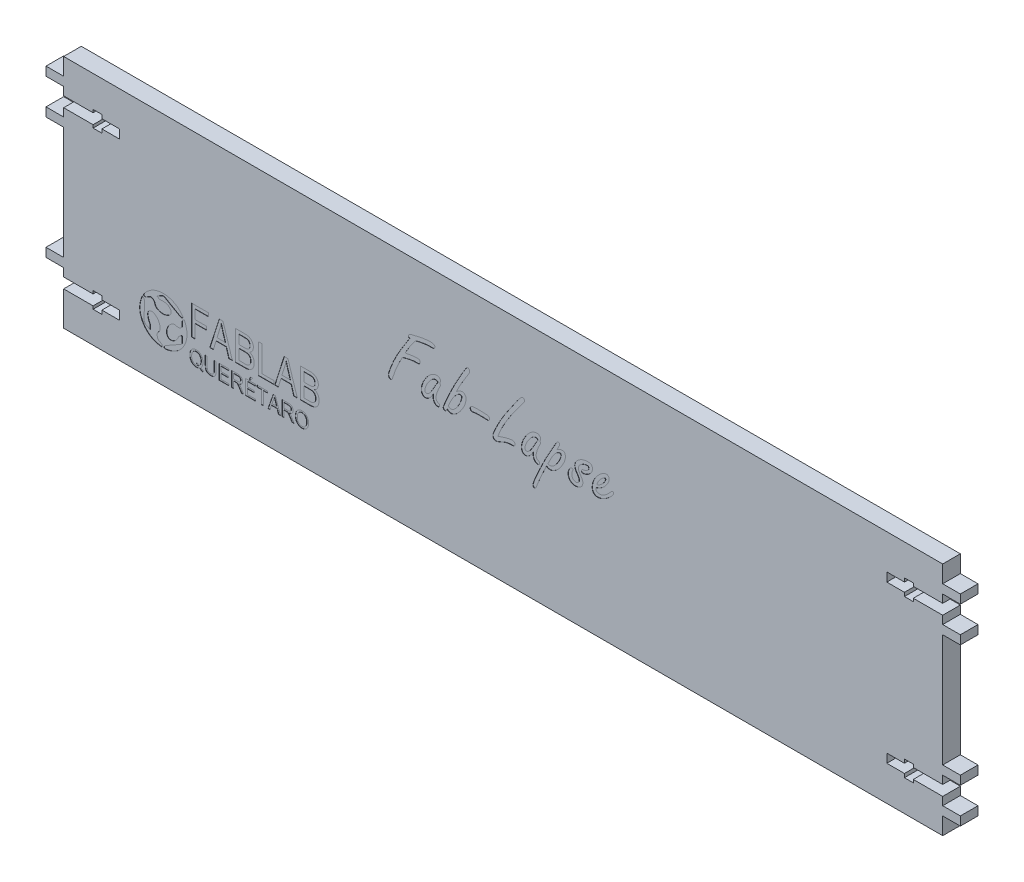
SolidWorks part; units mm, degrees
ref_plane "Front Plane" through (0, 0, 0) normal (0, 0, 1) x (1, 0, 0)
ref_plane "Top Plane" through (0, 0, 0) normal (0, 1, 0) x (1, 0, 0)
ref_plane "Right Plane" through (0, 0, 0) normal (1, 0, 0) x (0, 0, -1)
sketch "Sketch1" plane through (0, 0, 0) normal (0, 0, 1) x (1, 0, 0)
  line L1 (149.4, -40) -> (-149.4, -40)
  line L2 (149.4, -40) -> (149.4, 40)
  line L3 (149.4, 40) -> (-149.4, 40)
  line L4 (-149.4, -40) -> (-149.4, 40)
  line L5 (149.4, -40) -> (-149.4, 40) construction
  line L6 (149.4, 40) -> (-149.4, -40) construction
  point P0 (0, 0)
  dimension "D1" = 298.8
  dimension "D2" = 80
extrude "Boss-Extrude1" add sketch "Sketch1" along normal mid plane 6
sketch "Sketch2" plane through (0, 0, 3) normal (0, 0, 1) x (1, 0, 0)
  line L0 (0, 0) -> (0, 40)
  line L1 (149.4, 40) -> (-149.4, 40) construction
  line L2 (-149.4, 0) -> (0, 0) construction
  line L3 (-149.4, 40) -> (-149.4, -40) construction
  line L4 (149.4, 40) -> (155.4, 40) construction
  line L5 (155.4, 40) -> (155.4, -40) construction
  line L6 (155.4, -40) -> (149.4, -40) construction
  line L7 (155.4, 26.6667) -> (149.4, 26.6667) construction
  line L8 (149.4, -40) -> (149.4, 40) construction
  line L9 (149.4, 22.1667) -> (155.4, 22.1667)
  line L10 (149.4, 34.1667) -> (155.4, 34.1667)
  line L11 (149.4, 34.1667) -> (149.4, 31.1667)
  line L12 (149.4, 31.1667) -> (155.4, 31.1667)
  line L13 (155.4, 34.1667) -> (155.4, 31.1667)
  line L14 (155.4, 19.1667) -> (155.4, 22.1667)
  line L15 (149.4, 19.1667) -> (155.4, 19.1667)
  line L16 (149.4, 19.1667) -> (149.4, 22.1667)
  line L17 (149.4, -19.1667) -> (149.4, -22.1667)
  line L18 (149.4, -19.1667) -> (155.4, -19.1667)
  line L19 (155.4, -19.1667) -> (155.4, -22.1667)
  line L20 (149.4, -22.1667) -> (155.4, -22.1667)
  line L21 (149.4, -31.1667) -> (155.4, -31.1667)
  line L22 (155.4, -34.1667) -> (155.4, -31.1667)
  line L23 (149.4, -34.1667) -> (155.4, -34.1667)
  line L24 (149.4, -34.1667) -> (149.4, -31.1667)
  line L25 (-149.4, 19.1667) -> (-149.4, 22.1667)
  line L26 (-149.4, 19.1667) -> (-155.4, 19.1667)
  line L27 (-155.4, 19.1667) -> (-155.4, 22.1667)
  line L28 (-149.4, 22.1667) -> (-155.4, 22.1667)
  line L29 (-149.4, 31.1667) -> (-155.4, 31.1667)
  line L30 (-155.4, 34.1667) -> (-155.4, 31.1667)
  line L31 (-149.4, 34.1667) -> (-155.4, 34.1667)
  line L32 (-149.4, 34.1667) -> (-149.4, 31.1667)
  line L33 (-149.4, -34.1667) -> (-149.4, -31.1667)
  line L34 (-149.4, -34.1667) -> (-155.4, -34.1667)
  line L35 (-155.4, -34.1667) -> (-155.4, -31.1667)
  line L36 (-149.4, -31.1667) -> (-155.4, -31.1667)
  line L37 (-149.4, -19.1667) -> (-155.4, -19.1667)
  line L38 (-155.4, -19.1667) -> (-155.4, -22.1667)
  line L39 (-149.4, -22.1667) -> (-155.4, -22.1667)
  line L40 (-149.4, -19.1667) -> (-149.4, -22.1667)
  point P22 (155.4, 32.6667)
extrude "Boss-Extrude3" add sketch "Sketch2" against normal up to surface (6 mm away) contours L31 L30 L29 M22 | L28 L27 L26 M22 | L39 L37 L38 M22 | L13 L10 L12 M24 | L15 L14 L9 M24 | L20 L19 L18 M24 | L23 L22 L21 M24
sketch "Sketch4" plane through (0, 0, 3) normal (0, 0, 1) x (1, 0, 0)
  line L0 (0, 40) -> (0, 0) construction
  line L1 (149.4, 40) -> (-149.4, 40) construction
  line L2 (0, 0) -> (149.4, 0) construction
  line L3 (149.4, -19.1667) -> (149.4, 19.1667) construction
  line L4 (149.4, 31.1667) -> (149.4, 22.1667) construction
  line L5 (149.4, 22.1667) -> (149.4, -22.1667) construction
  line L6 (149.4, -22.1667) -> (149.4, -31.1667) construction
  line L7 (139.4, 24.9167) -> (139.4, 23.9108)
  line L8 (139.4, 28.4167) -> (149.4, 28.4167)
  line L10 (139.4, 24.9167) -> (149.4, 24.9167)
  line L11 (149.4, 28.4167) -> (149.4, 24.9167)
  line L12 (136.4, 29.4226) -> (139.4, 29.4226)
  line L13 (136.4, 29.4226) -> (136.4, 28.1667)
  line L14 (136.4, 23.9108) -> (139.4, 23.9108)
  line L15 (139.4, 29.4226) -> (139.4, 28.4167)
  line L16 (130.4, 28.1667) -> (136.4, 28.1667)
  line L17 (130.4, 28.1667) -> (130.4, 25.1667)
  line L18 (130.4, 25.1667) -> (136.4, 25.1667)
  line L20 (136.4, 25.1667) -> (136.4, 23.9108)
  line L21 (130.4, 26.6667) -> (149.4, 26.6667) construction
  line L22 (136.4, -29.4226) -> (136.4, -28.1667)
  line L23 (130.4, -28.1667) -> (136.4, -28.1667)
  line L24 (130.4, -28.1667) -> (130.4, -25.1667)
  line L25 (130.4, -25.1667) -> (136.4, -25.1667)
  line L26 (136.4, -25.1667) -> (136.4, -23.9108)
  line L27 (136.4, -23.9108) -> (139.4, -23.9108)
  line L28 (139.4, -24.9167) -> (139.4, -23.9108)
  line L29 (139.4, -24.9167) -> (149.4, -24.9167)
  line L30 (149.4, -28.4167) -> (149.4, -24.9167)
  line L31 (139.4, -28.4167) -> (149.4, -28.4167)
  line L32 (139.4, -29.4226) -> (139.4, -28.4167)
  line L33 (136.4, -29.4226) -> (139.4, -29.4226)
  line L34 (-136.4, -29.4226) -> (-139.4, -29.4226)
  line L35 (-139.4, -29.4226) -> (-139.4, -28.4167)
  line L36 (-139.4, -28.4167) -> (-149.4, -28.4167)
  line L37 (-149.4, -28.4167) -> (-149.4, -24.9167)
  line L38 (-139.4, -24.9167) -> (-149.4, -24.9167)
  line L39 (-139.4, -24.9167) -> (-139.4, -23.9108)
  line L40 (-136.4, -23.9108) -> (-139.4, -23.9108)
  line L41 (-136.4, -25.1667) -> (-136.4, -23.9108)
  line L42 (-130.4, -25.1667) -> (-136.4, -25.1667)
  line L43 (-130.4, -28.1667) -> (-130.4, -25.1667)
  line L44 (-130.4, -28.1667) -> (-136.4, -28.1667)
  line L45 (-136.4, -29.4226) -> (-136.4, -28.1667)
  line L46 (-136.4, 29.4226) -> (-136.4, 28.1667)
  line L47 (-130.4, 28.1667) -> (-136.4, 28.1667)
  line L48 (-130.4, 28.1667) -> (-130.4, 25.1667)
  line L49 (-130.4, 25.1667) -> (-136.4, 25.1667)
  line L50 (-136.4, 25.1667) -> (-136.4, 23.9108)
  line L51 (-136.4, 23.9108) -> (-139.4, 23.9108)
  line L52 (-139.4, 24.9167) -> (-139.4, 23.9108)
  line L53 (-139.4, 24.9167) -> (-149.4, 24.9167)
  line L54 (-149.4, 28.4167) -> (-149.4, 24.9167)
  line L55 (-139.4, 28.4167) -> (-149.4, 28.4167)
  line L56 (-139.4, 29.4226) -> (-139.4, 28.4167)
  line L57 (-136.4, 29.4226) -> (-139.4, 29.4226)
  line L58 (155.4, 31.1667) -> (155.4, 34.1667) construction
  point P30 (149.4, 26.6667)
  dimension "D1" = 3
  dimension "D2" = 25
  dimension "D3" = 3
  dimension "D4" = 5.5118
  dimension "D5" = 3.5
  dimension "D6" = 10
extrude "Cut-Extrude1" cut sketch "Sketch4" against normal through all
sketch "Sketch5" plane through (0, 0, 3) normal (0, 0, 1) x (1, 0, 0)
  line L0 (103.4598, 0) -> (-103.4598, 0) construction
  line L1 (-103.4598, 0) -> (-103.4598, -25.4098) construction
  line L2 (-103.4598, -25.4098) -> (-53.2233, -25.4098) construction
  line L3 (103.4598, 0) -> (103.4598, 21.5012) construction
  line L4 (103.4598, 21.5012) -> (65.08, 21.5012) construction
  line L5 (-106.8599, -20.8535) -> (-6.8599, -20.8535) construction
  line L6 (-106.8599, -12.832) -> (-106.8599, -28.8751) construction
  line L7 (-106.8599, -28.8751) -> (-6.8599, -28.8751) construction
  spline S41 degree 3 poles (-110.4424, -23.253) (-110.8115, -24.1562) (-111.4476, -24.8662) (-112.4127, -25.189) knots 7 7 7 7 8 8 8 8
  spline S42 degree 3 poles (-109.9657, -16.6792) (-111.6642, -15.6576) (-113.3896, -14.6793) (-115.1231, -13.7177) knots 2 2 2 2 3 3 3 3
  spline S43 degree 3 poles (-112.4127, -25.189) (-113.4, -25.519) (-114.188, -25.0436) (-114.3863, -24.0234) knots 8 8 8 8 9 9 9 9
  spline S44 degree 3 poles (-109.095, -23.8658) (-109.1369, -23.3168) (-109.1046, -22.7618) (-109.1046, -22.1295) knots 5 5 5 5 6 6 6 6
  spline S45 degree 3 poles (-115.1439, -28.8751) (-115.3462, -28.3496) (-115.2144, -28.037) (-114.7246, -27.7655) knots 2 2 2 2 3 3 3 3
  spline S46 degree 3 poles (-117.6442, -14.6795) (-117.1502, -15.0664) (-116.7191, -15.2634) (-116.1289, -15.1792) knots 5 5 5 5 6 6 6 6
  spline S47 degree 3 poles (-116.6979, -24.255) (-116.7618, -24.4751) (-116.8679, -24.7463) (-117.042, -24.8602) knots 10 10 10 10 11 11 11 11
  spline S48 degree 3 poles (-118.5425, -16.9452) (-118.6749, -16.4107) (-119.5806, -15.8104) (-120.0708, -16.073) knots 10 10 10 10 11 11 11 11
  spline S49 degree 3 poles (-109.1074, -19.3488) (-109.0921, -18.9392) (-109.071, -18.5252) (-109.1129, -18.1195) knots 12 12 12 12 13 13 13 13
  spline S50 degree 3 poles (-109.6631, -24.8854) (-109.2152, -24.6385) (-109.0576, -24.3573) (-109.095, -23.8658) knots 4 4 4 4 5 5 5 5
  spline S51 degree 3 poles (-122.3832, -24.9877) (-123.9049, -22.4692) (-123.8961, -19.8451) (-122.6854, -17.1803) knots 1 1 1 1 2 2 2 2
  spline S52 degree 3 poles (-108.7616, -16.5421) (-109.1199, -16.9739) (-109.4701, -16.9772) (-109.9657, -16.6792) knots 1 1 1 1 2 2 2 2
  spline S53 degree 3 poles (-122.3022, -16.5627) (-119.3848, -11.6974) (-111.944, -11.4704) (-108.7616, -16.5421) knots 0 0 0 0 1 1 1 1
  spline S54 degree 3 poles (-108.3819, -17.1376) (-107.1983, -19.5706) (-107.1139, -22.0328) (-108.3544, -24.4577) knots 0 0 0 0 1 1 1 1
  spline S55 degree 3 poles (-117.042, -24.8602) (-117.9014, -25.4231) (-117.573, -26.2812) (-117.4705, -26.9704) knots 11 11 11 11 12 12 12 12
  spline S56 degree 3 poles (-108.3544, -24.4577) (-109.7557, -27.1973) (-112.076, -28.6099) (-115.1439, -28.8751) knots 1 1 1 1 2 2 2 2
  spline S57 degree 3 poles (-110.746, -20.2596) (-110.2245, -20.444) (-109.1284, -19.9091) (-109.1074, -19.3488) knots 11 11 11 11 12 12 12 12
  spline S58 degree 3 poles (-119.9695, -25.7204) (-119.9853, -24.9556) (-119.888, -24.3565) (-120.242, -23.6989) knots 6 6 6 6 7 7 7 7
  spline S59 degree 3 poles (-117.8496, -18.2452) (-118.2004, -17.9441) (-118.4265, -17.4128) (-118.5425, -16.9452) knots 9 9 9 9 10 10 10 10
  spline S60 degree 3 poles (-115.1231, -13.7177) (-115.3321, -13.6017) (-115.6958, -13.5965) (-115.9142, -13.6981) knots 3 3 3 3 4 4 4 4
  spline S61 degree 3 poles (-112.0987, -20.1458) (-111.6864, -20.0298) (-111.1631, -20.1119) (-110.746, -20.2596) knots 10 10 10 10 11 11 11 11
  spline S62 degree 3 poles (-115.9705, -28.8144) (-118.7657, -28.6023) (-120.945, -27.3678) (-122.3832, -24.9877) knots 0 0 0 0 1 1 1 1
  spline S63 degree 3 poles (-120.832, -21.5054) (-120.8393, -20.3362) (-119.8917, -19.8071) (-118.7897, -20.211) knots 8 8 8 8 9 9 9 9
  spline S64 degree 3 poles (-121.3563, -24.9511) (-120.9106, -25.1443) (-120.5011, -25.4207) (-119.9695, -25.7204) knots 5 5 5 5 6 6 6 6
  spline S65 degree 3 poles (-116.3389, -27.8095) (-115.9382, -28.0299) (-115.7489, -28.2784) (-115.9705, -28.8144) knots 13 13 13 13 14 14 14 14
  spline S66 degree 3 poles (-122.0137, -23.8494) (-122.0233, -24.3989) (-121.866, -24.7305) (-121.3563, -24.9511) knots 4 4 4 4 5 5 5 5
  spline S67 degree 3 poles (-113.5978, -18.2899) (-114.7196, -19.1239) (-116.7937, -19.1513) (-117.8496, -18.2452) knots 8 8 8 8 9 9 9 9
  spline S68 degree 3 poles (-118.7897, -20.211) (-117.3585, -20.7356) (-116.2774, -22.8087) (-116.6979, -24.255) knots 9 9 9 9 10 10 10 10
  spline S69 degree 3 poles (-121.9892, -18.0877) (-122.0181, -20.0081) (-121.9805, -21.9292) (-122.0137, -23.8494) knots 3 3 3 3 4 4 4 4
  spline S70 degree 3 poles (-113.6045, -15.7537) (-112.6249, -16.4598) (-112.6283, -17.569) (-113.5978, -18.2899) knots 7 7 7 7 8 8 8 8
  spline S71 degree 3 poles (-115.9142, -13.6981) (-116.4919, -13.967) (-117.0293, -14.3228) (-117.6442, -14.6795) knots 4 4 4 4 5 5 5 5
  spline S72 degree 3 poles (-109.1046, -22.1295) (-109.7299, -22.3996) (-110.1907, -22.6368) (-110.4424, -23.253) knots 6 6 6 6 7 7 7 7
  spline S73 degree 3 poles (-117.4705, -26.9704) (-117.4212, -27.3022) (-116.7606, -27.5776) (-116.3389, -27.8095) knots 12 12 12 12 13 13 13 13
  spline S74 degree 3 poles (-114.7246, -27.7655) (-113.0269, -26.8247) (-111.3631, -25.8218) (-109.6631, -24.8854) knots 3 3 3 3 4 4 4 4
  spline S75 degree 3 poles (-121.0777, -16.654) (-121.5327, -16.9952) (-121.9237, -16.9995) (-122.3022, -16.5627) knots 12 12 12 12 13 13 13 13
  spline S76 degree 3 poles (-116.1289, -15.1792) (-115.2318, -15.0511) (-114.3602, -15.2091) (-113.6045, -15.7537) knots 6 6 6 6 7 7 7 7
  spline S77 degree 3 poles (-120.242, -23.6989) (-120.5941, -23.0451) (-120.8275, -22.2439) (-120.832, -21.5054) knots 7 7 7 7 8 8 8 8
  spline S78 degree 3 poles (-120.0708, -16.073) (-120.4127, -16.2562) (-120.7699, -16.4233) (-121.0777, -16.654) knots 11 11 11 11 12 12 12 12
  spline S79 degree 3 poles (-109.1129, -18.1195) (-109.1686, -17.5817) (-108.9921, -17.2486) (-108.3819, -17.1376) knots 13 13 13 13 14 14 14 14
  spline S80 degree 3 poles (-114.3863, -24.0234) (-114.671, -22.5599) (-113.5274, -20.5478) (-112.0987, -20.1458) knots 9 9 9 9 10 10 10 10
  spline S81 degree 3 poles (-122.6854, -17.1803) (-122.1285, -17.2776) (-121.9814, -17.5734) (-121.9892, -18.0877) knots 2 2 2 2 3 3 3 3
  text T0 "Fab-Lapse" font "Freestyle Script" height in points 72
  text T1 "FABLAB" font "Arial Narrow" height 10
  text T2 "QUERÉTARO" font "Arial Narrow" height 5
  dimension "D1" = 100
  dimension "D2" = 100
extrude "Cut-Extrude2" cut sketch "Sketch5" against normal blind 0.1
sketch "Sketch6" [suppressed] plane through (0, 0, -3) normal (0, 0, -1) x (-1, 0, 0)
  line L0 (98.8719, 0) -> (-98.8719, 0) construction
  line L1 (-98.8719, 0) -> (-98.8719, -27.6506) construction
  line L2 (-98.8719, -27.6506) -> (-65.9146, -27.6506) construction
  line L3 (98.8719, 0) -> (98.8719, 30.4436) construction
  line L4 (98.8719, 30.4436) -> (64.2388, 30.4436) construction
  line L5 (-110.8044, -33.1882) -> (-57.1679, -33.1882) construction
  line L6 (-110.8044, -25.1667) -> (-10.8044, -25.1667) construction
  line L7 (-110.8044, -17.1451) -> (-110.8044, -33.1882) construction
  spline S0 degree 3 poles (-114.387, -27.5662) (-114.7561, -28.4694) (-115.3922, -29.1793) (-116.3573, -29.5022) knots 7 7 7 7 8 8 8 8
  spline S1 degree 3 poles (-113.9102, -20.9923) (-115.6088, -19.9708) (-117.3341, -18.9925) (-119.0677, -18.0308) knots 2 2 2 2 3 3 3 3
  spline S2 degree 3 poles (-116.3573, -29.5022) (-117.3446, -29.8322) (-118.1326, -29.3567) (-118.3309, -28.3365) knots 8 8 8 8 9 9 9 9
  spline S3 degree 3 poles (-113.0396, -28.1789) (-113.0815, -27.6299) (-113.0492, -27.0749) (-113.0492, -26.4426) knots 5 5 5 5 6 6 6 6
  spline S4 degree 3 poles (-119.0885, -33.1882) (-119.2907, -32.6627) (-119.159, -32.3501) (-118.6692, -32.0787) knots 2 2 2 2 3 3 3 3
  spline S5 degree 3 poles (-121.5888, -18.9926) (-121.0947, -19.3795) (-120.6637, -19.5765) (-120.0735, -19.4923) knots 5 5 5 5 6 6 6 6
  spline S6 degree 3 poles (-120.6425, -28.5682) (-120.7064, -28.7882) (-120.8125, -29.0594) (-120.9865, -29.1733) knots 10 10 10 10 11 11 11 11
  spline S7 degree 3 poles (-122.4871, -21.2584) (-122.6195, -20.7239) (-123.5252, -20.1235) (-124.0154, -20.3861) knots 10 10 10 10 11 11 11 11
  spline S8 degree 3 poles (-113.052, -23.6619) (-113.0367, -23.2524) (-113.0156, -22.8383) (-113.0575, -22.4326) knots 12 12 12 12 13 13 13 13
  spline S9 degree 3 poles (-113.6077, -29.1986) (-113.1598, -28.9516) (-113.0022, -28.6704) (-113.0396, -28.1789) knots 4 4 4 4 5 5 5 5
  spline S10 degree 3 poles (-126.3278, -29.3008) (-127.8495, -26.7824) (-127.8407, -24.1582) (-126.6299, -21.4934) knots 1 1 1 1 2 2 2 2
  spline S11 degree 3 poles (-112.7062, -20.8553) (-113.0645, -21.2871) (-113.4146, -21.2904) (-113.9102, -20.9923) knots 1 1 1 1 2 2 2 2
  spline S12 degree 3 poles (-126.2467, -20.8758) (-123.3294, -16.0106) (-115.8886, -15.7835) (-112.7062, -20.8553) knots 0 0 0 0 1 1 1 1
  spline S13 degree 3 poles (-112.3264, -21.4507) (-111.1428, -23.8837) (-111.0585, -26.3459) (-112.299, -28.7709) knots 0 0 0 0 1 1 1 1
  spline S14 degree 3 poles (-120.9865, -29.1733) (-121.846, -29.7362) (-121.5176, -30.5944) (-121.4151, -31.2835) knots 11 11 11 11 12 12 12 12
  spline S15 degree 3 poles (-112.299, -28.7709) (-113.7003, -31.5104) (-116.0206, -32.9231) (-119.0885, -33.1882) knots 1 1 1 1 2 2 2 2
  spline S16 degree 3 poles (-114.6906, -24.5728) (-114.169, -24.7571) (-113.073, -24.2223) (-113.052, -23.6619) knots 11 11 11 11 12 12 12 12
  spline S17 degree 3 poles (-123.9141, -30.0335) (-123.9299, -29.2687) (-123.8326, -28.6697) (-124.1866, -28.0121) knots 6 6 6 6 7 7 7 7
  spline S18 degree 3 poles (-121.7942, -22.5583) (-122.145, -22.2572) (-122.3711, -21.7259) (-122.4871, -21.2584) knots 9 9 9 9 10 10 10 10
  spline S19 degree 3 poles (-119.0677, -18.0308) (-119.2766, -17.9148) (-119.6403, -17.9097) (-119.8588, -18.0113) knots 3 3 3 3 4 4 4 4
  spline S20 degree 3 poles (-116.0433, -24.4589) (-115.631, -24.3429) (-115.1077, -24.425) (-114.6906, -24.5728) knots 10 10 10 10 11 11 11 11
  spline S21 degree 3 poles (-119.9151, -33.1276) (-122.7103, -32.9154) (-124.8896, -31.681) (-126.3278, -29.3008) knots 0 0 0 0 1 1 1 1
  spline S22 degree 3 poles (-124.7765, -25.8186) (-124.7839, -24.6493) (-123.8363, -24.1202) (-122.7343, -24.5241) knots 8 8 8 8 9 9 9 9
  spline S23 degree 3 poles (-125.3009, -29.2642) (-124.8552, -29.4574) (-124.4456, -29.7339) (-123.9141, -30.0335) knots 5 5 5 5 6 6 6 6
  spline S24 degree 3 poles (-120.2835, -32.1227) (-119.8828, -32.343) (-119.6934, -32.5915) (-119.9151, -33.1276) knots 13 13 13 13 14 14 14 14
  spline S25 degree 3 poles (-125.9583, -28.1626) (-125.9679, -28.7121) (-125.8106, -29.0436) (-125.3009, -29.2642) knots 4 4 4 4 5 5 5 5
  spline S26 degree 3 poles (-117.5424, -22.603) (-118.6641, -23.437) (-120.7383, -23.4644) (-121.7942, -22.5583) knots 8 8 8 8 9 9 9 9
  spline S27 degree 3 poles (-122.7343, -24.5241) (-121.3031, -25.0487) (-120.222, -27.1218) (-120.6425, -28.5682) knots 9 9 9 9 10 10 10 10
  spline S28 degree 3 poles (-125.9338, -22.4008) (-125.9626, -24.3212) (-125.9251, -26.2423) (-125.9583, -28.1626) knots 3 3 3 3 4 4 4 4
  spline S29 degree 3 poles (-117.5491, -20.0669) (-116.5695, -20.7729) (-116.5729, -21.8822) (-117.5424, -22.603) knots 7 7 7 7 8 8 8 8
  spline S30 degree 3 poles (-119.8588, -18.0113) (-120.4365, -18.2801) (-120.9739, -18.6359) (-121.5888, -18.9926) knots 4 4 4 4 5 5 5 5
  spline S31 degree 3 poles (-113.0492, -26.4426) (-113.6745, -26.7128) (-114.1353, -26.95) (-114.387, -27.5662) knots 6 6 6 6 7 7 7 7
  spline S32 degree 3 poles (-121.4151, -31.2835) (-121.3658, -31.6153) (-120.7052, -31.8908) (-120.2835, -32.1227) knots 12 12 12 12 13 13 13 13
  spline S33 degree 3 poles (-118.6692, -32.0787) (-116.9715, -31.1378) (-115.3077, -30.135) (-113.6077, -29.1986) knots 3 3 3 3 4 4 4 4
  spline S34 degree 3 poles (-125.0223, -20.9671) (-125.4773, -21.3083) (-125.8683, -21.3126) (-126.2467, -20.8758) knots 12 12 12 12 13 13 13 13
  spline S35 degree 3 poles (-120.0735, -19.4923) (-119.1764, -19.3642) (-118.3048, -19.5222) (-117.5491, -20.0669) knots 6 6 6 6 7 7 7 7
  spline S36 degree 3 poles (-124.1866, -28.0121) (-124.5387, -27.3582) (-124.7721, -26.557) (-124.7765, -25.8186) knots 7 7 7 7 8 8 8 8
  spline S37 degree 3 poles (-124.0154, -20.3861) (-124.3572, -20.5693) (-124.7145, -20.7364) (-125.0223, -20.9671) knots 11 11 11 11 12 12 12 12
  spline S38 degree 3 poles (-113.0575, -22.4326) (-113.1131, -21.8948) (-112.9367, -21.5617) (-112.3264, -21.4507) knots 13 13 13 13 14 14 14 14
  spline S39 degree 3 poles (-118.3309, -28.3365) (-118.6155, -26.873) (-117.472, -24.861) (-116.0433, -24.4589) knots 9 9 9 9 10 10 10 10
  spline S40 degree 3 poles (-126.6299, -21.4934) (-126.0731, -21.5907) (-125.926, -21.8865) (-125.9338, -22.4008) knots 2 2 2 2 3 3 3 3
  text T0 "Fab-Lapse" font "Freestyle Script" height in points 72
  text T1 "FABLAB" font "Arial Narrow" height 10
  text T2 "QUERÉTARO" font "Arial Narrow" height 5
  point P4 (0, 0)
extrude "Cut-Extrude3" [suppressed] cut sketch "Sketch6" against normal blind 0.1
equation "\"D3@Sketch2\"=(\"D2@Sketch2\"/3)/2"
